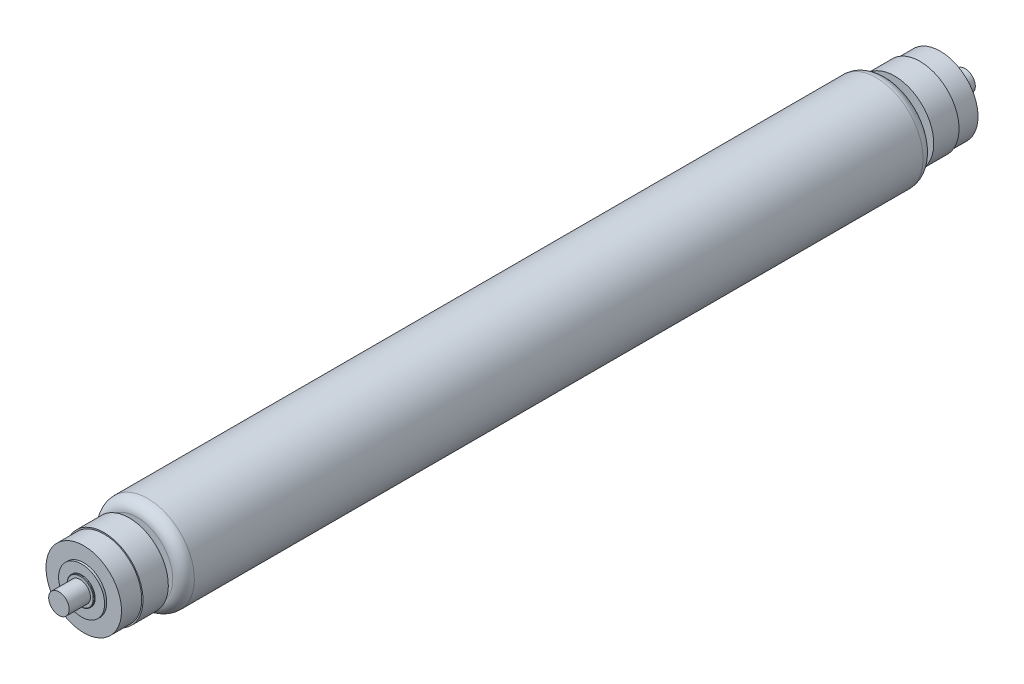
SolidWorks part; units mm, degrees
ref_plane "Front" through (0, 0, 0) normal (0, 0, 1) x (1, 0, 0)
ref_plane "Top" through (0, 0, 0) normal (0, 1, 0) x (1, 0, 0)
ref_plane "Right" through (0, 0, 0) normal (1, 0, 0) x (0, 0, -1)
sketch "Sketch3" plane through (0, 0, 0) normal (1, 0, 0) x (0, 0, -1)
  line L0 (-192.3288, -10.9855) -> (-20.8788, -10.9855)
  line L1 (-16.5608, -9.1821) -> (-10.6045, -9.1821)
  line L2 (-18.3388, -4.2073) -> (-18.3388, -8.4455)
  line L3 (-16.5608, -6.35) -> (-16.5608, -9.1821)
  line L4 (-18.3388, -9.5123) -> (-18.3388, -10.9855) construction
  line L5 (-106.6038, 0) -> (-106.6038, 4.5536) construction
  line L6 (-191.6938, -9.5123) -> (-191.6938, -10.9855) construction
  line L7 (-194.8688, -4.2073) -> (-196.6468, -6.35)
  line L8 (-21.5138, -9.5123) -> (-21.5138, -10.9855) construction
  line L9 (-5.842, -8.8847) -> (-10.6045, -8.8847)
  line L10 (-202.6031, -9.1821) -> (-202.6031, -8.8847)
  line L11 (-5.842, -8.8847) -> (-5.842, -5.4102)
  line L12 (-207.8736, -3.1927) -> (-208.0756, -3.1927)
  line L13 (-5.842, -5.4102) -> (-5.334, -5.4102)
  line L14 (-213.2076, -2.413) -> (-208.2038, -2.413)
  line L15 (-5.334, -5.4102) -> (-5.334, -3.1927)
  line L16 (-213.2076, -2.413) -> (-213.2076, 0)
  line L17 (-208.2038, -3.0645) -> (-208.2038, -2.413)
  line L18 (-208.2038, -3.0645) -> (-208.0756, -3.1927)
  line L19 (-5.0038, -3.0645) -> (-5.132, -3.1927)
  line L20 (-207.8736, -5.4102) -> (-207.8736, -3.1927)
  line L21 (-5.0038, -3.0645) -> (-5.0038, -2.413)
  line L22 (-207.3656, -5.4102) -> (-207.8736, -5.4102)
  line L23 (0, -2.413) -> (0, 0)
  line L24 (-207.3656, -8.8847) -> (-207.3656, -5.4102)
  line L25 (0, -2.413) -> (-5.0038, -2.413)
  line L26 (-207.3656, -8.8847) -> (-202.6031, -8.8847)
  line L27 (-5.334, -3.1927) -> (-5.132, -3.1927)
  line L28 (-10.6045, -9.1821) -> (-10.6045, -8.8847)
  line L29 (0, 0) -> (-33.2308, 0) construction
  line L30 (-196.6468, -6.35) -> (-196.6468, -9.1821)
  line L31 (-194.8688, -4.2073) -> (-194.8688, -8.4455)
  line L32 (-196.6468, -9.1821) -> (-202.6031, -9.1821)
  line L34 (-18.3388, -4.2073) -> (-16.5608, -6.35)
  line L35 (-213.2076, 0) -> (0, 0)
  line L37 (-208.2038, -119.75) -> (-208.2038, -101.6295) construction
  arc A0 (-18.3388, -8.4455) -> (-20.8788, -10.9855) centre (-20.8788, -8.4455) cw
  arc A1 (-194.8688, -8.4455) -> (-192.3288, -10.9855) centre (-192.3288, -8.4455) ccw
  dimension "D21" = 2.54
  dimension "D1" = 10.9855
  dimension "D3" = 16.5608
  dimension "D4" = 10.6045
  dimension "D5" = 5.842
  dimension "D6" = 5.334
  dimension "D7" = 5.0038
  dimension "D8" = 5.132
  dimension "D9" = 2.413
  dimension "D10" = 3.0645
  dimension "D11" = 3.1927
  dimension "D12" = 5.4102
  dimension "D13" = 8.8847
  dimension "D14" = 9.1821
  dimension "D15" = 6.35
  dimension "D16" = 5.0038
  dimension "D17" = 225
  dimension "D18" = 140.315
  dimension "D19" = 4.953
  dimension "D20" = 3.175
revolve "Revolve1" add sketch "Sketch3" angle 360 about L29
